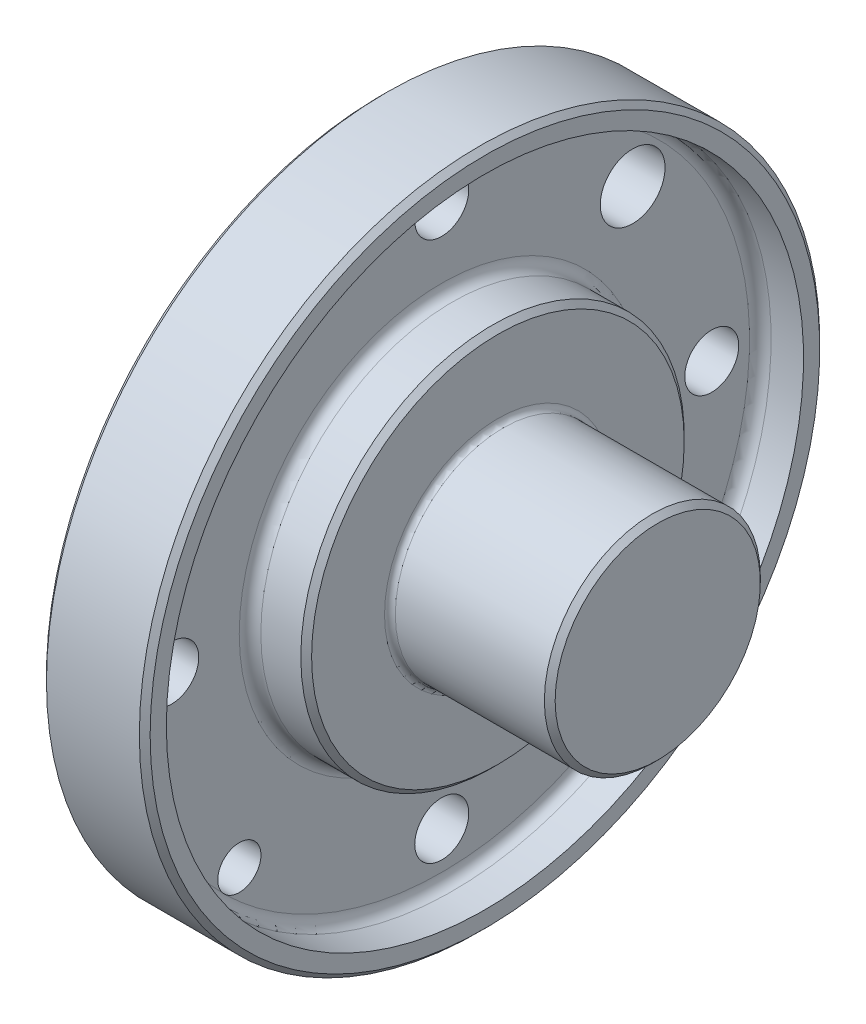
SolidWorks part; units mm, degrees
ref_plane "Front" through (0, 0, 0) normal (0, 0, 1) x (1, 0, 0)
ref_plane "Top" through (0, 0, 0) normal (0, 1, 0) x (1, 0, 0)
ref_plane "Right" through (0, 0, 0) normal (1, 0, 0) x (0, 0, -1)
other "Massenmittelpunkt"
imported_body "Defeature ausgeführt4"
other "Fläche löschen1"
